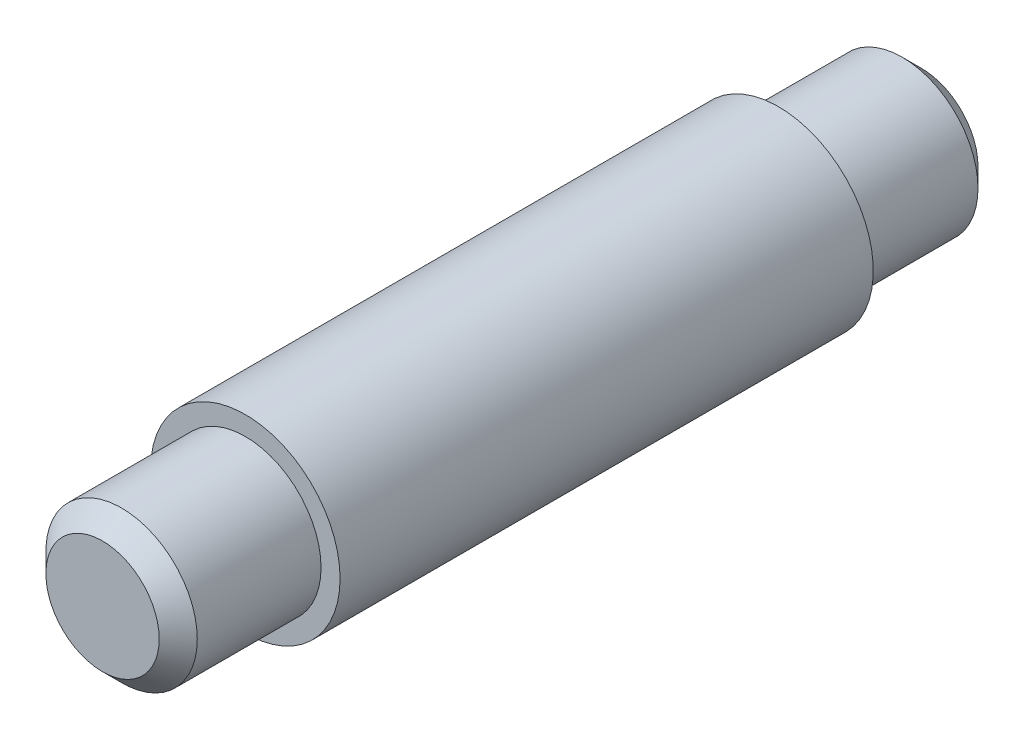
SolidWorks part; units mm, degrees
ref_plane "Front Plane" through (0, 0, 0) normal (0, 0, 1) x (1, 0, 0)
ref_plane "Top Plane" through (0, 0, 0) normal (0, 1, 0) x (1, 0, 0)
ref_plane "Right Plane" through (0, 0, 0) normal (1, 0, 0) x (0, 0, -1)
sketch "Sketch1" plane through (0, 0, 0) normal (0, 0, 1) x (1, 0, 0)
  circle A0 centre (0, 0) radius 9.95
  dimension "D1" = 19.9
extrude "Boss-Extrude1" add sketch "Sketch1" along normal mid plane 86
sketch "Sketch2" plane through (0, 0, 43) normal (0, 0, 1) x (1, 0, 0)
  circle A0 centre (0, 0) radius 7.95
  dimension "D1" = 15.9
extrude "Cut-Extrude1" cut sketch "Sketch2" against normal blind 15 contours A0 M2
sketch "Sketch3" plane through (0, 0, -43) normal (0, 0, -1) x (-1, 0, 0)
  circle A0 centre (0, 0) radius 7.95
  dimension "15.90" = 15.9
extrude "Cut-Extrude2" cut sketch "Sketch3" against normal blind 15 contours A0 M2
chamfer "Chamfer1" distance 2 angle 45 2 edges at (-7.95, 0, -43) (7.95, 0, 43)
